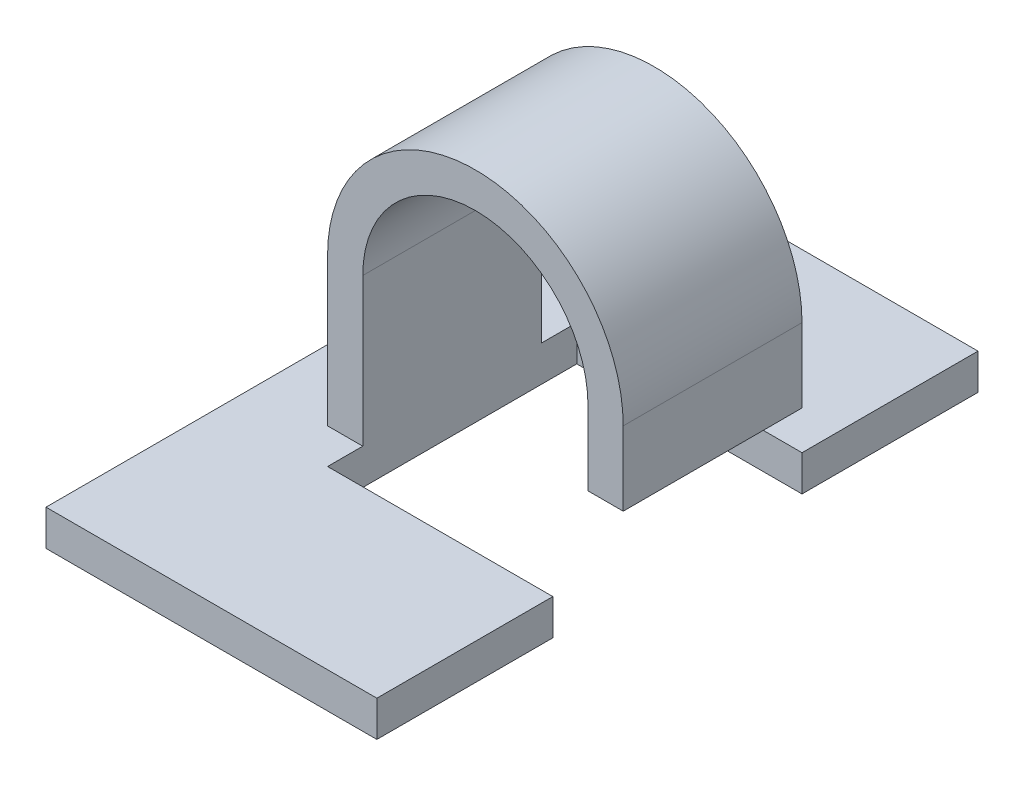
SolidWorks part; units mm, degrees
ref_plane "Front Plane" through (0, 0, 0) normal (0, 0, 1) x (1, 0, 0)
ref_plane "Top Plane" through (0, 0, 0) normal (0, 1, 0) x (1, 0, 0)
ref_plane "Right Plane" through (0, 0, 0) normal (1, 0, 0) x (0, 0, -1)
sketch "Sketch1" plane through (0, 0, 0) normal (0, 0, 1) x (1, 0, 0)
  line L0 (3.2, 0) -> (3.2, -2.1)
  line L1 (3.2, -2.1) -> (4.2, -2.1)
  line L2 (4.2, -2.1) -> (4.2, 0)
  line L3 (-4.2, 0) -> (-4.2, -4.2)
  line L4 (-4.2, -4.2) -> (-3.2, -4.2)
  line L5 (-3.2, -4.2) -> (-3.2, 0)
  line L6 (-3.2, -2.1) -> (3.2, -2.1) construction
  arc A0 (4.2, 0) -> (-4.2, 0) centre (0, 0) ccw
  arc A1 (-3.2, 0) -> (3.2, 0) centre (0, 0) cw
  dimension "TH" = 1
  dimension "D" = 4.2
extrude "Boss-Extrude1" add sketch "Sketch1" against normal mid plane 5.08
sketch "Sketch2" plane through (0, -4.2, 0) normal (0, -1, 0) x (1, 0, 0)
  line L0 (-6.2, -8.54) -> (-6.2, 8.54)
  line L1 (-6.2, 8.54) -> (3.2, 8.54)
  line L2 (3.2, 8.54) -> (3.2, 3.54)
  line L3 (3.2, 3.54) -> (-3.2, 3.54)
  line L4 (-3.2, 3.54) -> (-3.2, -3.54)
  line L5 (-3.2, -3.54) -> (3.2, -3.54)
  line L6 (3.2, -3.54) -> (3.2, -8.54)
  line L7 (3.2, -8.54) -> (-6.2, -8.54)
  line L8 (-3.2, -2.54) -> (-3.2, 2.54) construction
  line L9 (-4.2, -2.54) -> (4.2, -2.54) construction
  line L10 (3.2, -2.54) -> (3.2, 2.54) construction
  line L11 (-4.2, -2.54) -> (-4.2, 2.54) construction
  line L12 (0, 0) -> (-13.2197, 0) construction
  point P8 (-3.2, 0)
  dimension "D1" = 2
  dimension "D2" = 5
  dimension "D4" = 1
extrude "Boss-Extrude2" add sketch "Sketch2" along normal blind 1.016
sketch "Sketch3" plane through (0, 0, 2.54) normal (0, 0, 1) x (1, 0, 0)
  point P0 (0, 0)
sketch "Sketch4" plane through (0, 0, -2.54) normal (0, 0, -1) x (-1, 0, 0)
  point P0 (0, 0)
sketch "FilterSketch" plane through (0, 0, 0) normal (0, 0, 1) x (1, 0, 0)
  circle A0 centre (0, 0) radius 3.2
  circle A1 centre (0, 0) radius 2.35
  dimension "OuterDiameter" = 6.4
  dimension "NominalDiameter" = 6.4
  dimension "InnerDiameter" = 4.7
